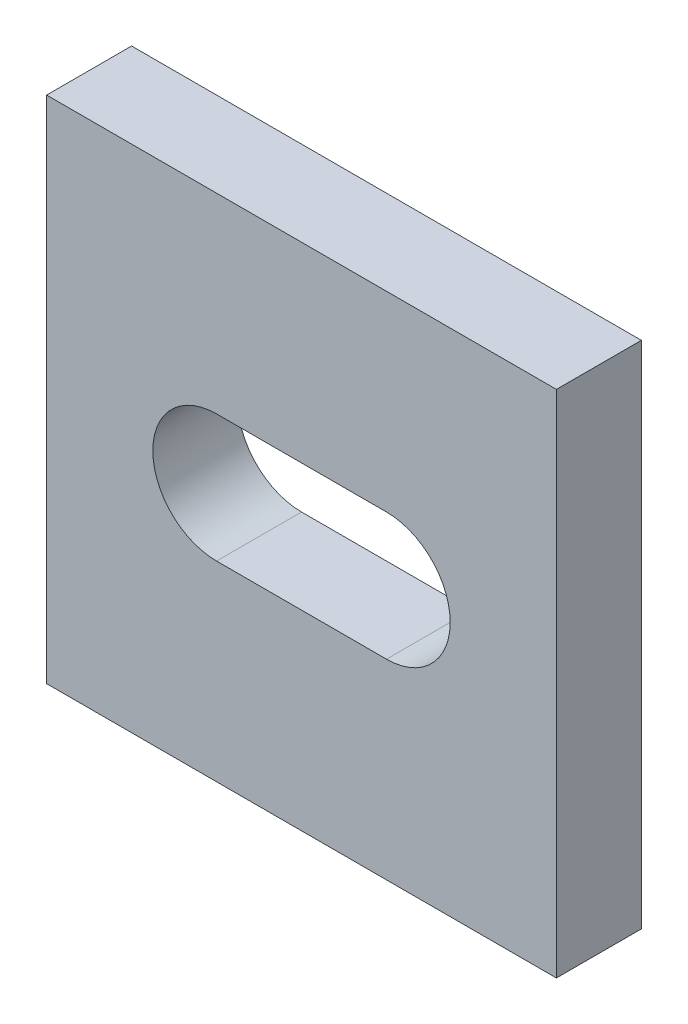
SolidWorks part; units mm, degrees
ref_plane "Ebene vorne" through (0, 0, 0) normal (0, 0, 1) x (1, 0, 0)
ref_plane "Ebene oben" through (0, 0, 0) normal (0, 1, 0) x (1, 0, 0)
ref_plane "Ebene rechts" through (0, 0, 0) normal (1, 0, 0) x (0, 0, -1)
sketch "Skizze1" plane through (0, 0, 0) normal (0, 0, 1) x (1, 0, 0)
  line L1 (0, 0) -> (60, 0)
  line L2 (0, 0) -> (0, 60)
  line L3 (0, 60) -> (60, 60)
  line L4 (60, 0) -> (60, 60)
  dimension "D1" = 60
extrude "Aufsatz-Linear austragen1" add sketch "Skizze1" along normal blind 10
sketch "Skizze2" plane through (0, 0, 10) normal (0, 0, 1) x (1, 0, 0)
  line L0 (20, 30) -> (40, 30) construction
  line L1 (20, 37.5) -> (40, 37.5)
  line L2 (20, 22.5) -> (40, 22.5)
  line L3 (0, 0) -> (60, 60) construction
  arc A0 (20, 37.5) -> (20, 22.5) centre (20, 30) ccw
  arc A1 (40, 22.5) -> (40, 37.5) centre (40, 30) ccw
  point P2 (30, 30)
  dimension "D2" = 35
  dimension "D1" = 15
extrude "Schnitt-Linear austragen1" cut sketch "Skizze2" against normal blind 10
